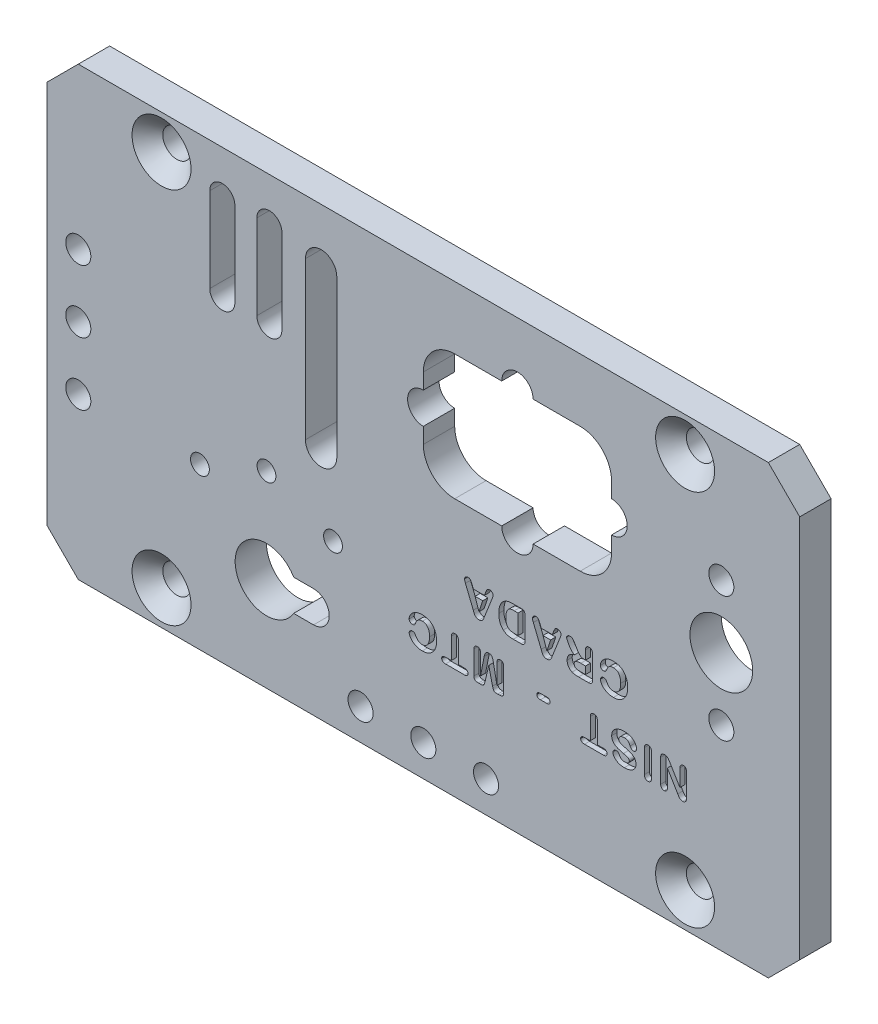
SolidWorks part; units mm, degrees
other "Title Block Table1"
other "General Table1"
other "DetailItem2"
other "DetailItem1"
other "DetailItem3"
other "DetailItem11"
ref_plane "Top Plane" through (0, 0, 0) normal (0, 0, 1) x (1, 0, 0)
ref_plane "Right Plane" through (0, 0, 0) normal (0, 1, 0) x (1, 0, 0)
ref_plane "Front Plane" through (0, 0, 0) normal (1, 0, 0) x (0, 0, -1)
sketch "Sketch1" plane through (0, 0, 0) normal (0, 0, 1) x (1, 0, 0)
  line L0 (60, 71.16) -> (60, 0) construction
  line L1 (0, 0) -> (120, 0)
  line L2 (0, 0) -> (0, 71.16)
  line L3 (0, 71.16) -> (120, 71.16)
  line L4 (120, 0) -> (120, 71.16)
  line L5 (0, 35.58) -> (120, 35.58) construction
  circle A0 centre (18.27, 65.66) radius 5.5 construction
  circle A1 centre (101.73, 65.66) radius 5.5 construction
  circle A2 centre (18.27, 5.5) radius 5.5 construction
  circle A3 centre (101.73, 5.5) radius 5.5 construction
  dimension "D3" = 11
  dimension "D4" = 83.46
  dimension "D1" = 120
  dimension "D2" = 71.16
  dimension "D5" = 60.16
extrude "5mm, Plate, Base" add sketch "Sketch1" along normal blind 5
hole_wizard "4X, Countersunk Hole, 4MM" positions "Sketch2" profile "Sketch3" countersink size "M4" standard "ANSI Metric"
sketch "Sketch2" plane through (0, 0, 5) normal (0, 0, 1) x (1, 0, 0)
  point P0 (101.73, 65.66)
  point P2 (18.27, 65.66)
  point P4 (18.27, 5.5)
  point P6 (101.73, 5.5)
sketch "Sketch3" plane through (101.73, 65.66, 5) normal (1, 0, 0) x (0, -1, 0)
  line L0 (0, 0) -> (0, 5)
  line L1 (0, 5) -> (2.25, 5)
  line L2 (2.25, 5) -> (2.25, 2.45)
  line L3 (2.25, 2.45) -> (4.7, 0)
  line L5 (4.7, 0) -> (0, 0)
  line L6 (-2.25, 2.45) -> (-4.7, 0) construction
  line L11 (0, -6.35) -> (0, 107.95) construction
  dimension "Thru Hole Dia." = 4.5
  dimension "Thru Hole Depth" = 5
  dimension "Near C'Sink Dia." = 9.4
  dimension "Near C'Sink Angle" = 90
chamfer "Chamfer, 5mm, Corners, Plate" distance 5 angle 45 4 edges at (0, 0, 2.5) (0, 71.16, 2.5) (120, 71.16, 2.5) (120, 0, 2.5)
sketch "Sketch4" plane through (0, 0, 5) normal (0, 0, 1) x (1, 0, 0)
  line L0 (77.5, 41.16) -> (85, 41.16)
  line L1 (65, 61.16) -> (72.5, 61.16)
  line L2 (60, 56.16) -> (60, 53.66)
  line L3 (65, 41.16) -> (72.5, 41.16)
  line L4 (90, 56.16) -> (90, 53.66)
  line L5 (60, 48.66) -> (60, 46.16)
  line L6 (77.5, 61.16) -> (85, 61.16)
  line L7 (90, 48.66) -> (90, 46.16)
  line L8 (115, 71.16) -> (5, 71.16) construction
  line L9 (120, 5) -> (120, 66.16) construction
  line L10 (42.5, 17.5) -> (39.3301, 17.5)
  line L11 (42.5, 12.5) -> (39.3301, 12.5)
  line L12 (5, 0) -> (115, 0) construction
  line L13 (0, 66.16) -> (0, 5) construction
  arc A0 (77.5, 61.16) -> (72.5, 61.16) centre (75, 61.16) ccw
  arc A1 (90, 48.66) -> (90, 53.66) centre (90, 51.16) ccw
  arc A2 (72.5, 41.16) -> (77.5, 41.16) centre (75, 41.16) ccw
  arc A3 (60, 53.66) -> (60, 48.66) centre (60, 51.16) ccw
  arc A4 (60, 46.16) -> (65, 41.16) centre (65, 46.16) ccw
  arc A5 (85, 41.16) -> (90, 46.16) centre (85, 46.16) ccw
  arc A6 (90, 56.16) -> (85, 61.16) centre (85, 56.16) ccw
  arc A7 (65, 61.16) -> (60, 56.16) centre (65, 56.16) ccw
  arc A8 (39.3301, 17.5) -> (39.3301, 12.5) centre (35, 15) ccw
  arc A9 (42.5, 12.5) -> (42.5, 17.5) centre (42.5, 15) ccw
  circle A10 centre (35, 15) radius 15 construction
  circle A11 centre (107.5, 41.16) radius 5
  circle A12 centre (107.5, 41.16) radius 12.5 construction
  point P20 (90, 41.16)
  point P23 (90, 61.16)
  point P26 (60, 61.16)
extrude "Ports, Plate" cut sketch "Sketch4" against normal through all
hole_wizard "Hole, Ø3.0, Plate" positions "Sketch5" profile "Sketch6" hole size "Ø3.0" standard "ANSI Metric"
sketch "Sketch5" plane through (0, 0, 5) normal (0, 0, 1) x (1, 0, 0)
  line L0 (35, 15) -> (24.3934, 25.6066) construction
  line L2 (5, 0) -> (115, 0) construction
  circle A0 centre (35, 15) radius 15 construction
  point P0 (24.3934, 25.6066)
  dimension "D1" = 45
sketch "Sketch6" plane through (24.3934, 25.6066, 5) normal (1, 0, 0) x (0, -1, 0)
  line L0 (0, 0) -> (0, 5)
  line L1 (0, 5) -> (1.5, 5)
  line L2 (1.5, 5) -> (1.5, 0)
  line L5 (1.5, 0) -> (0, 0)
  line L11 (0, -6.35) -> (0, 107.95) construction
  dimension "Thru Hole Dia." = 3
  dimension "Thru Hole Depth" = 5
pattern_circular "2X, Pattern, Hole, Ø3.0, Plate" count 3 every 45 about axis through (35, 15, 0) along (0, 0, 1) of "Hole, Ø3.0, Plate"
hole_wizard "2X, Slot, Ø4.0, Plate" positions "Sketch10" profile "Sketch9" size "Ø4.0" standard "ANSI Metric"
sketch "Sketch10" plane through (0, 0, 5) normal (0, 0, 1) x (1, 0, 0)
  line L0 (27.9571, 48.66) -> (27.9571, 66.16) construction
  line L2 (115, 71.16) -> (5, 71.16) construction
  circle A0 centre (27.9571, 66.16) radius 5 construction
  circle A1 centre (18.27, 65.66) radius 4.7 construction
  circle A2 centre (27.9571, 48.66) radius 5 construction
  point P0 (27.9571, 57.41)
  point P4 (35.4571, 57.41)
  dimension "D4" = 10
  dimension "D1" = 17.5
  dimension "D2" = 7.5
sketch "Sketch9" plane through (27.9571, 57.41, 5) normal (1, 0, 0) x (0, -1, 0)
  line L0 (0, 0) -> (0, 5)
  line L1 (0, 5) -> (2, 5)
  line L2 (2, 5) -> (2, 0)
  line L5 (2, 0) -> (0, 0)
  line L11 (0, -6.35) -> (0, 107.95) construction
  dimension "Thru Hole Dia." = 4
  dimension "Thru Hole Depth" = 5
hole_wizard "Slot, Ø5.0, Plate" positions "Sketch11" profile "Sketch12" size "Ø5.0" standard "ANSI Metric"
sketch "Sketch11" plane through (0, 0, 5) normal (0, 0, 1) x (1, 0, 0)
  line L0 (43.7071, 34.91) -> (43.7071, 64.91) construction
  line L1 (115, 71.16) -> (5, 71.16) construction
  line L2 (37.4571, 50.66) -> (37.4571, 64.16) construction
  circle A0 centre (43.7071, 64.91) radius 6.25 construction
  circle A1 centre (43.7071, 34.91) radius 6.25 construction
  point P0 (43.7071, 49.91)
  dimension "D2" = 12.5
  dimension "D1" = 30
sketch "Sketch12" plane through (43.7071, 49.91, 5) normal (1, 0, 0) x (0, -1, 0)
  line L0 (0, 0) -> (0, 5)
  line L1 (0, 5) -> (2.5, 5)
  line L2 (2.5, 5) -> (2.5, 0)
  line L5 (2.5, 0) -> (0, 0)
  line L11 (0, -6.35) -> (0, 107.95) construction
  dimension "Thru Hole Dia." = 5
  dimension "Thru Hole Depth" = 5
hole_wizard "6X, Hole, Ø4.0, Plate" positions "Sketch13" profile "Sketch14" hole size "Ø4.0" standard "ANSI Metric"
sketch "Sketch13" plane through (0, 0, 5) normal (0, 0, 1) x (1, 0, 0)
  line L0 (0, 66.16) -> (0, 5) construction
  line L1 (5, 0) -> (115, 0) construction
  circle A0 centre (5, 45.58) radius 5 construction
  circle A1 centre (5, 35.58) radius 5 construction
  circle A2 centre (5, 25.58) radius 5 construction
  circle A3 centre (50, 5) radius 5 construction
  circle A4 centre (60, 5) radius 5 construction
  circle A5 centre (70, 5) radius 5 construction
  point P0 (5, 45.58)
  point P2 (5, 35.58)
  point P4 (5, 25.58)
  point P6 (50, 5)
  point P8 (60, 5)
  point P10 (70, 5)
  point P38 (0, 35.58)
  point P43 (60, 0)
  dimension "D1" = 10
sketch "Sketch14" plane through (5, 45.58, 5) normal (1, 0, 0) x (0, -1, 0)
  line L0 (0, 0) -> (0, 5)
  line L1 (0, 5) -> (2, 5)
  line L2 (2, 5) -> (2, 0)
  line L5 (2, 0) -> (0, 0)
  line L11 (0, -6.35) -> (0, 107.95) construction
  dimension "Thru Hole Dia." = 4
  dimension "Thru Hole Depth" = 5
hole_wizard "2X, Hole, Ø4.0, Port, Round" positions "Sketch16" profile "Sketch17" hole size "Ø4.0" standard "ANSI Metric"
sketch "Sketch16" plane through (0, 0, 5) normal (0, 0, 1) x (1, 0, 0)
  line L0 (107.5, 51.16) -> (107.5, 31.16) construction
  circle A0 centre (107.5, 51.16) radius 5 construction
  circle A1 centre (107.5, 31.16) radius 5 construction
  circle A2 centre (107.5, 41.16) radius 5 construction
  point P0 (107.5, 51.16)
  point P2 (107.5, 31.16)
  point P18 (107.5, 41.16)
  dimension "D1" = 10
sketch "Sketch17" plane through (107.5, 51.16, 5) normal (1, 0, 0) x (0, -1, 0)
  line L0 (0, 0) -> (0, 5)
  line L1 (0, 5) -> (2, 5)
  line L2 (2, 5) -> (2, 0)
  line L5 (2, 0) -> (0, 0)
  line L11 (0, -6.35) -> (0, 107.95) construction
  dimension "Thru Hole Dia." = 4
  dimension "Thru Hole Depth" = 5
sketch "Sketch15" plane through (0, 0, 5) normal (0, 0, 1) x (1, 0, 0)
  line L0 (39.3301, 22.5) -> (120, 22.5) construction
  line L2 (120, 5) -> (120, 66.16) construction
  line L3 (5, 0) -> (115, 0) construction
  text T0 "<b>NIST  -  MTC</b>  <b>CRADA</b>" font "Arial Rounded MT Bold" height 5
  dimension "D1" = 22.5
extrude "Engraving, Text" cut sketch "Sketch15" against normal blind 0.8128
equation "\"D5@Sketch4\"=\"D1@Sketch4\"/2"
equation "\"D8@Sketch4\"=\"D2@Sketch4\"/2"
equation "\"D14@Sketch4\"=2.5*\"D13@Sketch4\""
